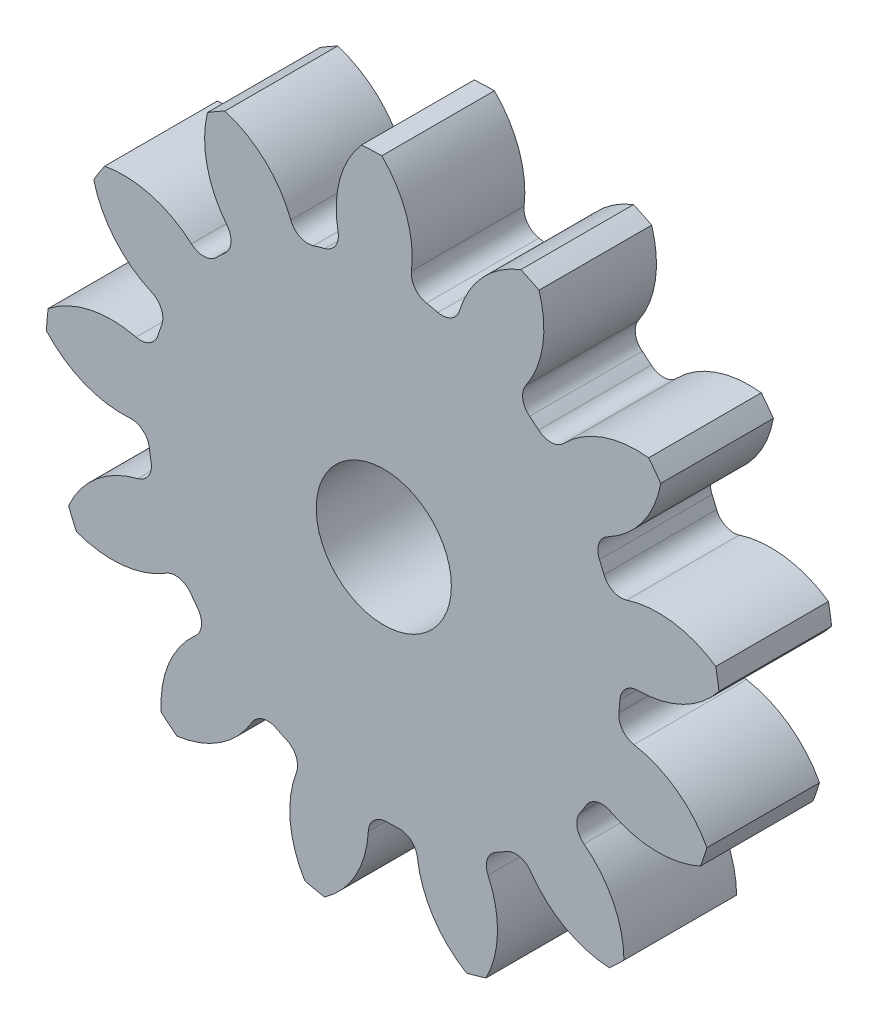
SolidWorks part; units mm, degrees
ref_plane "Front" through (0, 0, 0) normal (0, 0, 1) x (1, 0, 0)
ref_plane "Top" through (0, 0, 0) normal (0, 1, 0) x (1, 0, 0)
ref_plane "Right" through (0, 0, 0) normal (1, 0, 0) x (0, 0, -1)
sketch "Sketch3" plane through (0, 0, 0) normal (0, 0, 1) x (1, 0, 0)
  circle A0 centre (0, 0) radius 381
  dimension "od" = 762
extrude "gearBody" add sketch "Sketch3" along normal blind 127
sketch "Sketch2" plane through (0, 0, 0) normal (0, 0, 1) x (1, 0, 0)
  line L0 (0, 0) -> (286.6674, 118.7415) construction
  line L1 (366.6554, -116.0261) -> (0, 0) construction
  line L2 (0, 0) -> (36.3143, 0) construction
  line L3 (329.9887, 11.8118) -> (323.2328, -67.4729) construction
  line L5 (326.6107, -27.8306) -> (0, 0) construction
  line L7 (0, 0) -> (310.2865, 0) construction
  arc A0 (310.2323, 5.8017) -> (304.7781, -58.2069) centre (0, 0) ccw construction
  arc A1 (377.942, 48.175) -> (364.3425, -111.4252) centre (0, 0) ccw construction
  arc A2 (329.9887, 11.8118) -> (323.2328, -67.4729) centre (0, 0) ccw construction
  arc A3 (265.0953, -29.2123) -> (266.216, -16.0609) centre (0, 0) ccw
  arc A4 (366.6554, -116.0261) -> (282.1204, -51.8496) centre (262.4444, -165.5314) ccw
  arc A5 (366.6554, -116.0261) -> (381, 52.3182) centre (0, 0) ccw
  arc A6 (381, 52.3182) -> (286.8257, 3.3696) centre (286.6674, 118.7415) cw
  arc A7 (266.216, -16.0609) -> (286.8257, 3.3696) centre (286.854, -17.306) cw
  arc A8 (282.1204, -51.8496) -> (265.0953, -29.2123) centre (285.6465, -31.4769) cw
  point P6 (381, 52.3182)
  point P22 (366.6554, -116.0261)
  dimension "baseDia" = 620.573
  dimension "od" = 762
  dimension "pd" = 660.4
  dimension "rd" = 533.4
  dimension "rFillet" = 20.6756
  dimension "pointX" = 381
  dimension "pointY" = 52.3182
  dimension "CTT" = 79.2847
  dimension "flankCenterAngle" = 22.5
extrude "toothCut" cut sketch "Sketch2" along normal through all
pattern_circular "CirPattern1" count 13 over 360 about axis through (0, 0, 0) along (0, 0, 1) of "toothCut"
sketch "hub1Dia" plane through (0, 0, 0) normal (0, 0, -1) x (-1, 0, 0)
  circle A0 centre (0, 0) radius 12.7
  dimension "hub1Dia" = 25.4
sketch "hub2Dia" plane through (0, 0, 127) normal (0, 0, 1) x (1, 0, 0)
  circle A0 centre (0, 0) radius 12.7
  dimension "hub2dia" = 25.4
sketch "boreDia" plane through (0, 0, 0) normal (0, 0, 1) x (1, 0, 0)
  circle A0 centre (0, 0) radius 76.2
  dimension "boreDia" = 152.4
extrude "bore" cut sketch "boreDia" against normal mid plane 25400
